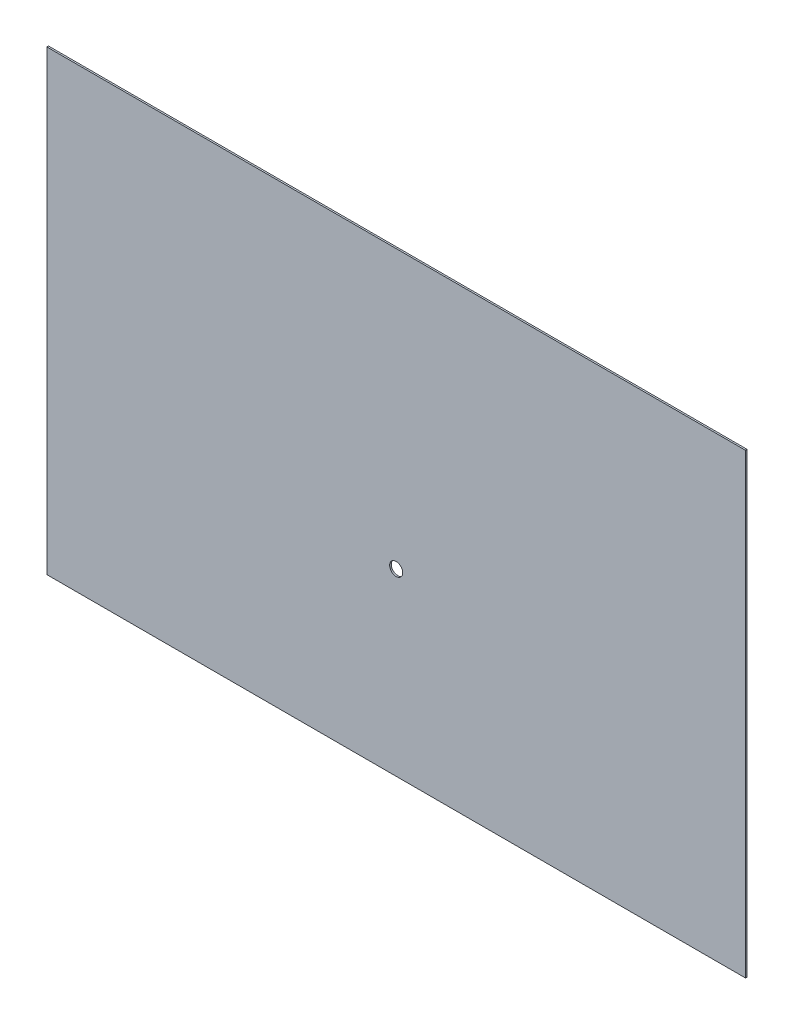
SolidWorks part; units mm, degrees
ref_plane "Plan de face" through (0, 0, 0) normal (0, 0, 1) x (1, 0, 0)
ref_plane "Plan de dessus" through (0, 0, 0) normal (0, 1, 0) x (1, 0, 0)
ref_plane "Plan de droite" through (0, 0, 0) normal (1, 0, 0) x (0, 0, -1)
sketch "Esquisse1" plane through (0, 0, 0) normal (0, 0, 1) x (1, 0, 0)
  line L1 (0, 0) -> (428, 0)
  line L2 (0, 0) -> (0, 280)
  line L3 (0, 280) -> (428, 280)
  line L4 (428, 0) -> (428, 280)
  circle A0 centre (214, 110) radius 4
  dimension "D5" = 8
  dimension "D1" = 428
  dimension "D2" = 280
  dimension "D3" = 110
  dimension "D4" = 214
extrude "Boss.-Extru.1" add sketch "Esquisse1" along normal blind 1
